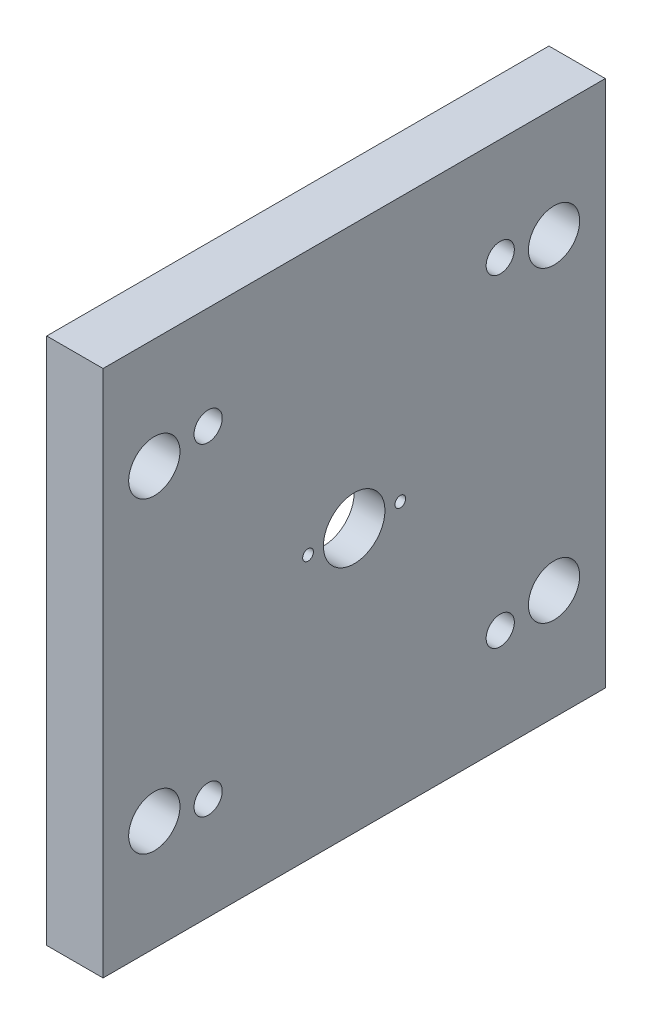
SolidWorks part; units mm, degrees
ref_plane "Plan de face" through (0, 0, 0) normal (0, 0, 1) x (1, 0, 0)
ref_plane "Plan de dessus" through (0, 0, 0) normal (0, 1, 0) x (1, 0, 0)
ref_plane "Plan de droite" through (0, 0, 0) normal (1, 0, 0) x (0, 0, -1)
imported_body "Importée1"
sketch "Esquisse1" plane through (-22, 0, 0) normal (-1, 0, 0) x (0, 0, 1)
  circle A0 centre (0, 0) radius 12
  dimension "D1" = 24
extrude "Extrusion1" cut sketch "Esquisse1" against normal through all
sketch "Esquisse2" plane through (-22, 0, 0) normal (-1, 0, 0) x (0, 0, 1)
  circle A0 centre (0, 0) radius 25
  dimension "D1" = 50
extrude "Extrusion2" cut sketch "Esquisse2" against normal blind 10
hole_wizard "Trou taraudé M52" positions "Esquisse3D2" profile "Esquisse4" tap size "M5" standard "ISO"
sketch3d "Esquisse3D2"
  line L1 (0, 0, 0) -> (0, 0, 16.4582) construction
  line L3 (0, 0, 0) -> (0, 0, -17.9555) construction
  circle A0 centre (-12, 0, 0) radius 12 construction
  point P0 (-12, -0.0006, -18)
  point P2 (-12, 0.0014, 18)
  point P27 (0, 0, 0)
  dimension "D2" = 18
  dimension "D1" = 36
sketch "Esquisse4" plane through (-12, -0.0006, -18) normal (0, 1, 0) x (0, 0, 1)
  line L0 (0, 0) -> (0, 15.2618)
  line L1 (0, 15.2618) -> (2.1, 14)
  line L2 (2.1, 14) -> (2.1, 0)
  line L5 (2.1, 0) -> (0, 0)
  line L10 (0, 15.2618) -> (-2.1, 14) construction
  line L11 (0, -6.35) -> (0, 107.95) construction
  dimension "Diamètre du trou pour taraudage" = 4.2
  dimension "Profondeur du trou pour taraudage" = 14
  dimension "Angle de pointe" = 118
sketch "Esquisse6" plane through (-22, 0, 0) normal (-1, 0, 0) x (0, 0, 1)
  line L0 (-92.4301, 0) -> (81.9827, 0) construction
  line L1 (0, 87.0613) -> (0, -77.1944) construction
  point P6 (0, 0)
  point P7 (40, 0)
  point P8 (-40, 0)
  dimension "D1" = 80
hole_wizard "Trou taraudé M53" positions "Esquisse3D3" profile "Esquisse7" tap size "M5" standard "ISO"
sketch3d "Esquisse3D3"
  point P0 (-22, 0, -40)
  point P3 (-22, 0, 40)
  dimension "D1" = 80
sketch "Esquisse7" plane through (-22, 0, -40) normal (0, 1, 0) x (0, 0, 1)
  line L0 (0, 0) -> (0, 15.2618)
  line L1 (0, 15.2618) -> (2.1, 14)
  line L2 (2.1, 14) -> (2.1, 0)
  line L5 (2.1, 0) -> (0, 0)
  line L10 (0, 15.2618) -> (-2.1, 14) construction
  line L11 (0, -6.35) -> (0, 107.95) construction
  dimension "Diamètre du trou pour taraudage" = 4.2
  dimension "Profondeur du trou pour taraudage" = 14
  dimension "Angle de pointe" = 118
